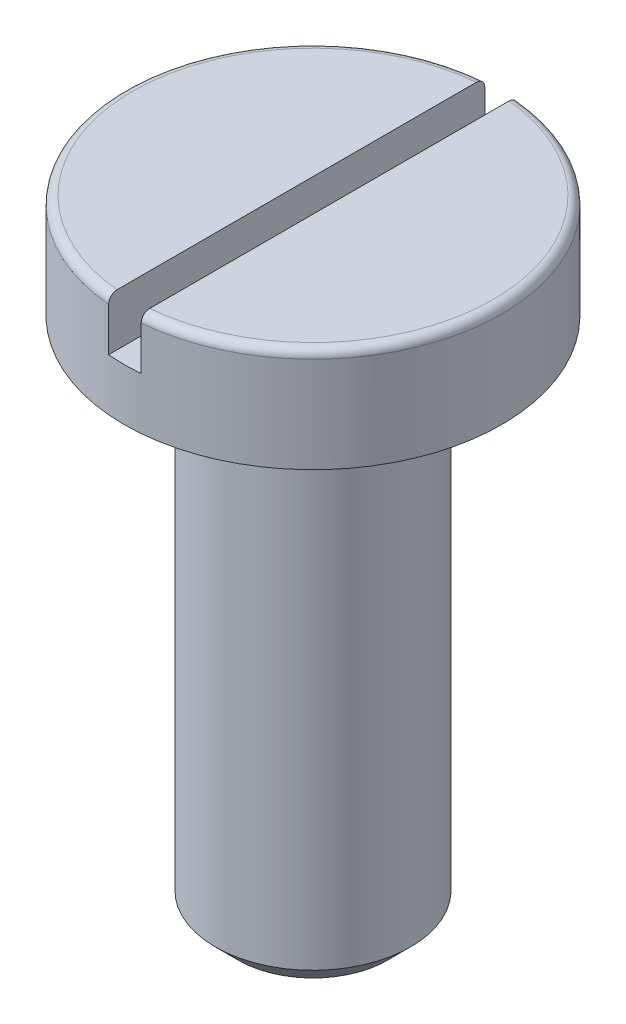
SolidWorks part; units mm, degrees
ref_plane "Face" through (0, 0, 0) normal (0, 0, 1) x (1, 0, 0)
ref_plane "Dessus" through (0, 0, 0) normal (0, 1, 0) x (1, 0, 0)
ref_plane "Droite" through (0, 0, 0) normal (1, 0, 0) x (0, 0, -1)
sketch "Esquisse1" plane through (0, 0, 0) normal (0, 1, 0) x (1, 0, 0)
  circle A0 centre (0, 0) radius 1.5
  dimension "Diamètre nominal" = 3
extrude "Base-Extrusion" add sketch "Esquisse1" against normal blind 8
chamfer "Chanfrein1" distance 0.35 angle 45 1 edges at (0, -8, 1.5)
sketch "Esquisse2" plane through (0, 0, 0) normal (0, 0, 1) x (1, 0, 0)
  line L0 (0, 1.6) -> (0, 0)
  line L2 (0, 0) -> (2.9, 0)
  line L4 (0, 1.6) -> (2.77, 1.6)
  line L5 (2.9, 0) -> (2.9, 1.47)
  line L7 (0, 1.3) -> (0, -8) construction
  line L8 (0, -7.65) -> (0, 0) construction
  line L9 (-1.15, -8) -> (1.15, -8) construction
  arc A0 (2.9, 1.47) -> (2.77, 1.6) centre (2.77, 1.47) ccw
  dimension "D2" = 0.13
  dimension "D1" = 5.8
  dimension "Hauteur tête" = 1.6
revolve "Boss.-Révol.1" add sketch "Esquisse2" angle 360 about L7
sketch "Esquisse3" plane through (0, 1.6, 0) normal (0, 1, 0) x (-1, 0, 0)
  line L0 (0, -2.9) -> (0, 2.9) construction
  line L1 (0.25, -2.9) -> (-0.25, -2.9)
  line L2 (0.25, 2.9) -> (-0.25, 2.9)
  line L3 (0.25, -2.9) -> (0.25, 2.9)
  line L4 (-0.25, -2.9) -> (-0.25, 2.9)
  circle A0 centre (0, 0) radius 2.9 construction
  dimension "Largeur fente" = 0.5
extrude "Enlèv. mat.-Extru.1" cut sketch "Esquisse3" against normal blind 0.8
